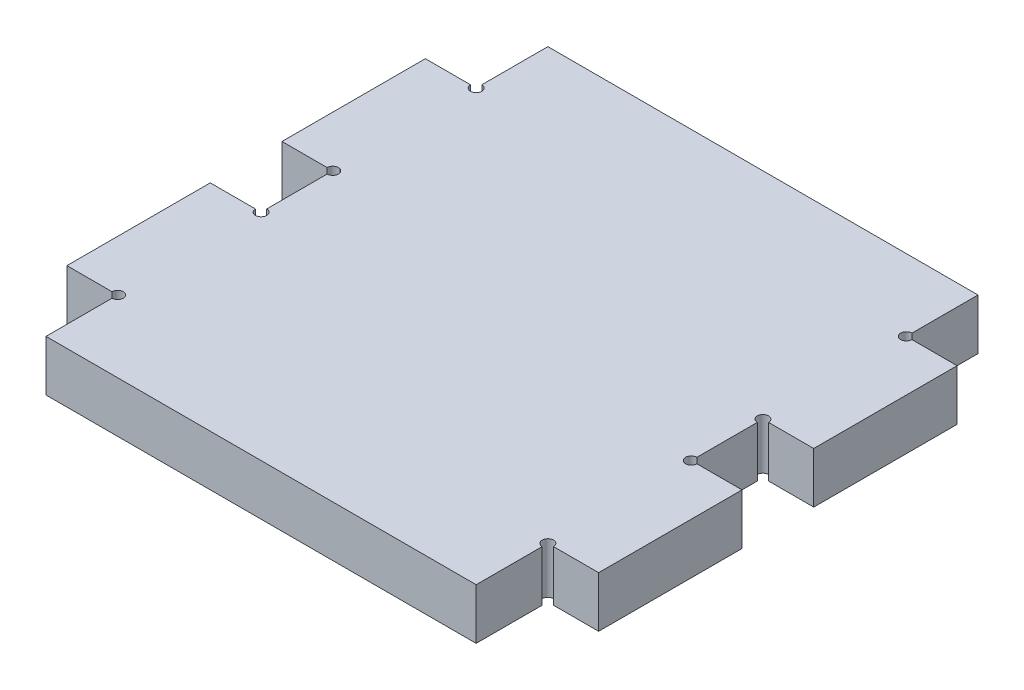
SolidWorks part; units mm, degrees
ref_plane "Front Plane" through (0, 0, 0) normal (0, 0, 1) x (1, 0, 0)
ref_plane "Top Plane" through (0, 0, 0) normal (0, 1, 0) x (1, 0, 0)
ref_plane "Right Plane" through (0, 0, 0) normal (1, 0, 0) x (0, 0, -1)
sketch "Sketch1" plane through (0, 0, 0) normal (0, 1, 0) x (1, 0, 0)
  line L0 (19.05, 44.45) -> (19.05, 0) construction
  line L1 (0, 0) -> (38.1, 0)
  line L2 (0, 0) -> (0, 44.45)
  line L3 (0, 44.45) -> (38.1, 44.45)
  line L4 (38.1, 0) -> (38.1, 44.45)
  line L5 (0, 22.225) -> (38.1, 22.225) construction
  line L6 (0, 25.4) -> (-4.5, 25.4)
  line L7 (0, 25.4) -> (0, 38.1)
  line L8 (0, 38.1) -> (-4.5, 38.1)
  line L9 (-4.5, 25.4) -> (-4.5, 38.1)
  line L10 (-4.5, 19.05) -> (-4.5, 6.35)
  line L11 (0, 19.05) -> (-4.5, 19.05)
  line L12 (0, 6.35) -> (-4.5, 6.35)
  line L13 (38.1, 6.35) -> (42.6, 6.35)
  line L14 (42.6, 19.05) -> (42.6, 6.35)
  line L15 (38.1, 19.05) -> (42.6, 19.05)
  line L16 (38.1, 25.4) -> (42.6, 25.4)
  line L17 (42.6, 25.4) -> (42.6, 38.1)
  line L18 (38.1, 38.1) -> (42.6, 38.1)
  arc A0 (-0.5, 38.1) -> (0, 38.6) centre (0, 38.1) ccw
  arc A1 (-0.5, 25.4) -> (0, 24.9) centre (0, 25.4) cw
  arc A2 (38.6, 38.1) -> (38.1, 38.6) centre (38.1, 38.1) cw
  arc A3 (38.6, 25.4) -> (38.1, 24.9) centre (38.1, 25.4) ccw
  arc A4 (38.6, 6.35) -> (38.1, 5.85) centre (38.1, 6.35) ccw
  arc A5 (38.6, 19.05) -> (38.1, 19.55) centre (38.1, 19.05) cw
  arc A6 (-0.5, 19.05) -> (0, 19.55) centre (0, 19.05) ccw
  arc A7 (-0.5, 6.35) -> (0, 5.85) centre (0, 6.35) cw
  point P8 (19.05, 44.45)
  dimension "D6" = 0.5
  dimension "D7" = 0.5
  dimension "D1" = 12.7
  dimension "D2" = 6.35
  dimension "D3" = 44.45
  dimension "D4" = 38.1
  dimension "D5" = 4.5
extrude "Boss-Extrude2" add sketch "Sketch1" along normal blind 4.5 contours L12 L2 L11 L10 | L9 L6 L2 L8 | L1 L4 L3 L2 | L15 L4 L13 L14 | L18 L4 L16 L17
